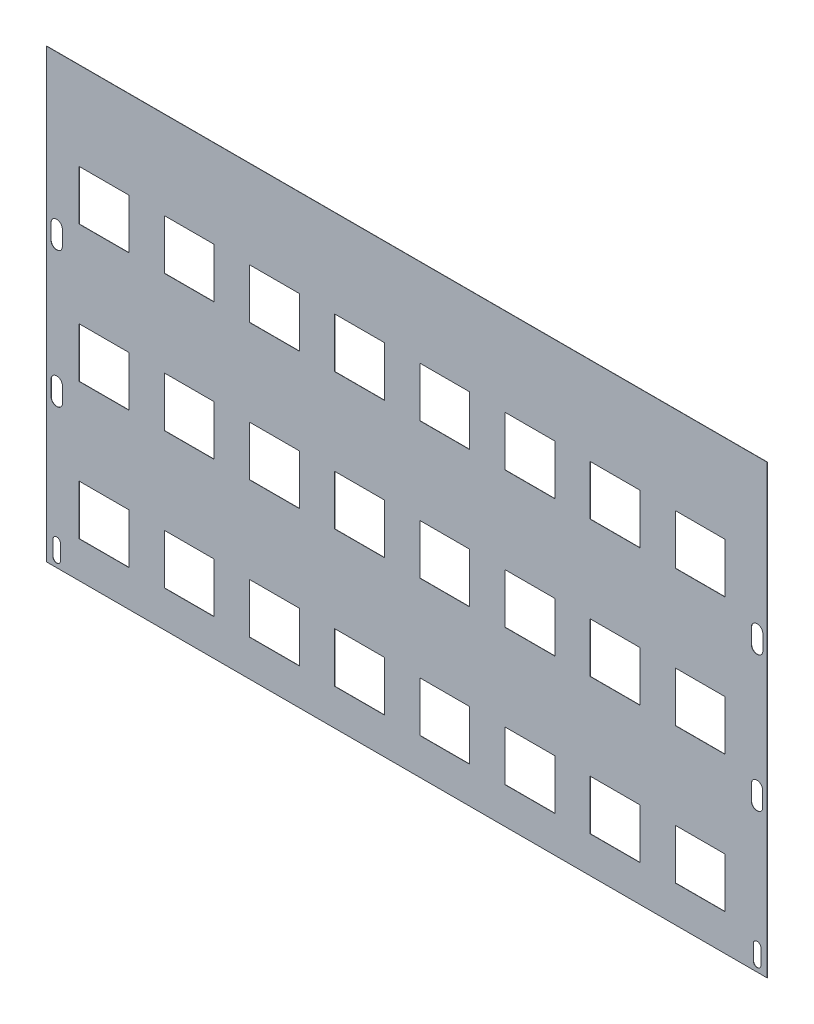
SolidWorks part; units mm, degrees
ref_plane "Front Plane" through (0, 0, 0) normal (0, 0, 1) x (1, 0, 0)
ref_plane "Top Plane" through (0, 0, 0) normal (0, 1, 0) x (1, 0, 0)
ref_plane "Right Plane" through (0, 0, 0) normal (1, 0, 0) x (0, 0, -1)
sketch "Model" plane through (0, 0, 0) normal (0, 0, 1) x (1, 0, 0)
  line L0 (1790, 440) -> (1640, 440)
  line L1 (1640, 440) -> (1640, 595)
  line L2 (1640, 595) -> (1650, 595)
  line L3 (1650, 595) -> (1650, 662)
  line L4 (1650, 662) -> (1780, 662)
  line L5 (1780, 662) -> (1780, 595)
  line L6 (1780, 595) -> (1790, 595)
  line L7 (1790, 595) -> (1790, 440)
  line L8 (1595, 440) -> (1445, 440)
  line L9 (1445, 440) -> (1445, 595)
  line L10 (1445, 595) -> (1455, 595)
  line L11 (1455, 595) -> (1455, 662)
  line L12 (1455, 662) -> (1585, 662)
  line L13 (1585, 662) -> (1585, 595)
  line L14 (1585, 595) -> (1595, 595)
  line L15 (1595, 595) -> (1595, 440)
  line L16 (1400, 440) -> (1250, 440)
  line L17 (1250, 440) -> (1250, 595)
  line L18 (1250, 595) -> (1260, 595)
  line L19 (1260, 595) -> (1260, 662)
  line L20 (1260, 662) -> (1390, 662)
  line L21 (1390, 662) -> (1390, 595)
  line L22 (1390, 595) -> (1400, 595)
  line L23 (1400, 595) -> (1400, 440)
  line L24 (1205, 440) -> (1055, 440)
  line L25 (1055, 440) -> (1055, 595)
  line L26 (1055, 595) -> (1065, 595)
  line L27 (1065, 595) -> (1065, 662)
  line L28 (1065, 662) -> (1195, 662)
  line L29 (1195, 662) -> (1195, 595)
  line L30 (1195, 595) -> (1205, 595)
  line L31 (1205, 595) -> (1205, 440)
  line L32 (1010, 440) -> (860, 440)
  line L33 (860, 440) -> (860, 595)
  line L34 (860, 595) -> (870, 595)
  line L35 (870, 595) -> (870, 662)
  line L36 (870, 662) -> (1000, 662)
  line L37 (1000, 662) -> (1000, 595)
  line L38 (1000, 595) -> (1010, 595)
  line L39 (1010, 595) -> (1010, 440)
  line L40 (815, 440) -> (665, 440)
  line L41 (665, 440) -> (665, 595)
  line L42 (665, 595) -> (675, 595)
  line L43 (675, 595) -> (675, 662)
  line L44 (675, 662) -> (805, 662)
  line L45 (805, 662) -> (805, 595)
  line L46 (805, 595) -> (815, 595)
  line L47 (815, 595) -> (815, 440)
  line L48 (620, 440) -> (470, 440)
  line L49 (470, 440) -> (470, 595)
  line L50 (470, 595) -> (480, 595)
  line L51 (480, 595) -> (480, 662)
  line L52 (480, 662) -> (610, 662)
  line L53 (610, 662) -> (610, 595)
  line L54 (610, 595) -> (620, 595)
  line L55 (620, 595) -> (620, 440)
  line L56 (425, 440) -> (275, 440)
  line L57 (275, 440) -> (275, 595)
  line L58 (275, 595) -> (285, 595)
  line L59 (285, 595) -> (285, 662)
  line L60 (285, 662) -> (415, 662)
  line L61 (415, 662) -> (415, 595)
  line L62 (415, 595) -> (425, 595)
  line L63 (425, 595) -> (425, 440)
  line L64 (230, 440) -> (80, 440)
  line L65 (80, 440) -> (80, 595)
  line L66 (80, 595) -> (90, 595)
  line L67 (90, 595) -> (90, 662)
  line L68 (90, 662) -> (220, 662)
  line L69 (220, 662) -> (220, 595)
  line L70 (220, 595) -> (230, 595)
  line L71 (230, 595) -> (230, 440)
  line L72 (1790, 805) -> (1640, 805)
  line L73 (1640, 805) -> (1640, 960)
  line L74 (1640, 960) -> (1650, 960)
  line L75 (1650, 960) -> (1650, 1027)
  line L76 (1650, 1027) -> (1780, 1027)
  line L77 (1780, 1027) -> (1780, 960)
  line L78 (1780, 960) -> (1790, 960)
  line L79 (1790, 960) -> (1790, 805)
  line L80 (1595, 805) -> (1445, 805)
  line L81 (1445, 805) -> (1445, 960)
  line L82 (1445, 960) -> (1455, 960)
  line L83 (1455, 960) -> (1455, 1027)
  line L84 (1455, 1027) -> (1585, 1027)
  line L85 (1585, 1027) -> (1585, 960)
  line L86 (1585, 960) -> (1595, 960)
  line L87 (1595, 960) -> (1595, 805)
  line L88 (1400, 805) -> (1250, 805)
  line L89 (1250, 805) -> (1250, 960)
  line L90 (1250, 960) -> (1260, 960)
  line L91 (1260, 960) -> (1260, 1027)
  line L92 (1260, 1027) -> (1390, 1027)
  line L93 (1390, 1027) -> (1390, 960)
  line L94 (1390, 960) -> (1400, 960)
  line L95 (1400, 960) -> (1400, 805)
  line L96 (1205, 805) -> (1055, 805)
  line L97 (1055, 805) -> (1055, 960)
  line L98 (1055, 960) -> (1065, 960)
  line L99 (1065, 960) -> (1065, 1027)
  line L100 (1065, 1027) -> (1195, 1027)
  line L101 (1195, 1027) -> (1195, 960)
  line L102 (1195, 960) -> (1205, 960)
  line L103 (1205, 960) -> (1205, 805)
  line L104 (1010, 805) -> (860, 805)
  line L105 (860, 805) -> (860, 960)
  line L106 (860, 960) -> (870, 960)
  line L107 (870, 960) -> (870, 1027)
  line L108 (870, 1027) -> (1000, 1027)
  line L109 (1000, 1027) -> (1000, 960)
  line L110 (1000, 960) -> (1010, 960)
  line L111 (1010, 960) -> (1010, 805)
  line L112 (815, 805) -> (665, 805)
  line L113 (665, 805) -> (665, 960)
  line L114 (665, 960) -> (675, 960)
  line L115 (675, 960) -> (675, 1027)
  line L116 (675, 1027) -> (805, 1027)
  line L117 (805, 1027) -> (805, 960)
  line L118 (805, 960) -> (815, 960)
  line L119 (815, 960) -> (815, 805)
  line L120 (620, 805) -> (470, 805)
  line L121 (470, 805) -> (470, 960)
  line L122 (470, 960) -> (480, 960)
  line L123 (480, 960) -> (480, 1027)
  line L124 (480, 1027) -> (610, 1027)
  line L125 (610, 1027) -> (610, 960)
  line L126 (610, 960) -> (620, 960)
  line L127 (620, 960) -> (620, 805)
  line L128 (425, 805) -> (275, 805)
  line L129 (275, 805) -> (275, 960)
  line L130 (275, 960) -> (285, 960)
  line L131 (285, 960) -> (285, 1027)
  line L132 (285, 1027) -> (415, 1027)
  line L133 (415, 1027) -> (415, 960)
  line L134 (415, 960) -> (425, 960)
  line L135 (425, 960) -> (425, 805)
  line L136 (230, 805) -> (80, 805)
  line L137 (80, 805) -> (80, 960)
  line L138 (80, 960) -> (90, 960)
  line L139 (90, 960) -> (90, 1027)
  line L140 (90, 1027) -> (220, 1027)
  line L141 (220, 1027) -> (220, 960)
  line L142 (220, 960) -> (230, 960)
  line L143 (230, 960) -> (230, 805)
  line L144 (1790, 75) -> (1640, 75)
  line L145 (1640, 75) -> (1640, 230)
  line L146 (1640, 230) -> (1650, 230)
  line L147 (1650, 230) -> (1650, 297)
  line L148 (1650, 297) -> (1780, 297)
  line L149 (1780, 297) -> (1780, 230)
  line L150 (1780, 230) -> (1790, 230)
  line L151 (1790, 230) -> (1790, 75)
  line L152 (1595, 75) -> (1445, 75)
  line L153 (1445, 75) -> (1445, 230)
  line L154 (1445, 230) -> (1455, 230)
  line L155 (1455, 230) -> (1455, 297)
  line L156 (1455, 297) -> (1585, 297)
  line L157 (1585, 297) -> (1585, 230)
  line L158 (1585, 230) -> (1595, 230)
  line L159 (1595, 230) -> (1595, 75)
  line L160 (1400, 75) -> (1250, 75)
  line L161 (1250, 75) -> (1250, 230)
  line L162 (1250, 230) -> (1260, 230)
  line L163 (1260, 230) -> (1260, 297)
  line L164 (1260, 297) -> (1390, 297)
  line L165 (1390, 297) -> (1390, 230)
  line L166 (1390, 230) -> (1400, 230)
  line L167 (1400, 230) -> (1400, 75)
  line L168 (1205, 75) -> (1055, 75)
  line L169 (1055, 75) -> (1055, 230)
  line L170 (1055, 230) -> (1065, 230)
  line L171 (1065, 230) -> (1065, 297)
  line L172 (1065, 297) -> (1195, 297)
  line L173 (1195, 297) -> (1195, 230)
  line L174 (1195, 230) -> (1205, 230)
  line L175 (1205, 230) -> (1205, 75)
  line L176 (1010, 75) -> (860, 75)
  line L177 (860, 75) -> (860, 230)
  line L178 (860, 230) -> (870, 230)
  line L179 (870, 230) -> (870, 297)
  line L180 (870, 297) -> (1000, 297)
  line L181 (1000, 297) -> (1000, 230)
  line L182 (1000, 230) -> (1010, 230)
  line L183 (1010, 230) -> (1010, 75)
  line L184 (815, 75) -> (665, 75)
  line L185 (665, 75) -> (665, 230)
  line L186 (665, 230) -> (675, 230)
  line L187 (675, 230) -> (675, 297)
  line L188 (675, 297) -> (805, 297)
  line L189 (805, 297) -> (805, 230)
  line L190 (805, 230) -> (815, 230)
  line L191 (815, 230) -> (815, 75)
  line L192 (620, 75) -> (470, 75)
  line L193 (470, 75) -> (470, 230)
  line L194 (470, 230) -> (480, 230)
  line L195 (480, 230) -> (480, 297)
  line L196 (480, 297) -> (610, 297)
  line L197 (610, 297) -> (610, 230)
  line L198 (610, 230) -> (620, 230)
  line L199 (620, 230) -> (620, 75)
  line L200 (425, 75) -> (275, 75)
  line L201 (275, 75) -> (275, 230)
  line L202 (275, 230) -> (285, 230)
  line L203 (285, 230) -> (285, 297)
  line L204 (285, 297) -> (415, 297)
  line L205 (415, 297) -> (415, 230)
  line L206 (415, 230) -> (425, 230)
  line L207 (425, 230) -> (425, 75)
  line L208 (230, 75) -> (80, 75)
  line L209 (80, 75) -> (80, 230)
  line L210 (80, 230) -> (90, 230)
  line L211 (90, 230) -> (90, 297)
  line L212 (90, 297) -> (220, 297)
  line L213 (220, 297) -> (220, 230)
  line L214 (220, 230) -> (230, 230)
  line L215 (230, 230) -> (230, 75)
  line L216 (0, 1180) -> (0, 0)
  line L217 (0, 0) -> (1870, 0)
  line L218 (1870, 0) -> (1870, 1180)
  line L219 (1870, 1180) -> (0, 1180)
  dimension "D1" = 3
base flange "Base-Flange1" sketch "Model" thickness 0.6 reverse thickness direction no parameters "D1"=0.7366
sketch "Sketch6" plane through (0, 0, 0) normal (0, 0, 1) x (1, 0, 0)
  line L3 (1705, 805) -> (1725, 805)
  line L7 (1725, 1027) -> (1705, 1027)
  line L8 (1779, 1026) -> (1725, 1026)
  line L9 (1651, 1026) -> (1651, 959)
  line L10 (1651, 959) -> (1641, 959)
  line L11 (1641, 959) -> (1641, 806)
  line L12 (1641, 806) -> (1705, 806)
  line L13 (1789, 806) -> (1789, 959)
  line L14 (1789, 959) -> (1779, 959)
  line L15 (1779, 959) -> (1779, 1026)
  line L16 (1705, 1026) -> (1651, 1026)
  line L17 (1780, 1027) -> (1650, 1027) construction
  line L18 (1705, 1027) -> (1705, 1026)
  line L19 (1725, 1027) -> (1725, 1026)
  line L20 (1705, 806) -> (1705, 805)
  line L21 (1725, 806) -> (1725, 805)
  line L22 (1725, 806) -> (1789, 806)
  line L23 (1641, 806) -> (1789, 806) construction
  line L24 (1779, 1026) -> (1651, 1026) construction
  line L25 (1640, 805) -> (1790, 805) construction
  line L26 (1650, 1027) -> (1650, 960) construction
  line L27 (1650, 960) -> (1640, 960) construction
  line L28 (1640, 960) -> (1640, 805) construction
  line L29 (1790, 805) -> (1790, 960) construction
  line L30 (1790, 960) -> (1780, 960) construction
  line L31 (1780, 960) -> (1780, 1027) construction
  line L32 (1705, 440) -> (1725, 440)
  line L33 (1725, 662) -> (1705, 662)
  line L34 (1779, 661) -> (1725, 661)
  line L35 (1651, 661) -> (1651, 594)
  line L36 (1651, 594) -> (1641, 594)
  line L37 (1641, 594) -> (1641, 441)
  line L38 (1641, 441) -> (1705, 441)
  line L39 (1789, 441) -> (1789, 594)
  line L40 (1789, 594) -> (1779, 594)
  line L41 (1779, 594) -> (1779, 661)
  line L42 (1705, 661) -> (1651, 661)
  line L43 (1705, 662) -> (1705, 661)
  line L44 (1725, 662) -> (1725, 661)
  line L45 (1705, 441) -> (1705, 440)
  line L46 (1725, 441) -> (1725, 440)
  line L47 (1725, 441) -> (1789, 441)
  line L48 (1705, 75) -> (1725, 75)
  line L49 (1725, 297) -> (1705, 297)
  line L50 (1779, 296) -> (1725, 296)
  line L51 (1651, 296) -> (1651, 229)
  line L52 (1651, 229) -> (1641, 229)
  line L53 (1641, 229) -> (1641, 76)
  line L54 (1641, 76) -> (1705, 76)
  line L55 (1789, 76) -> (1789, 229)
  line L56 (1789, 229) -> (1779, 229)
  line L57 (1779, 229) -> (1779, 296)
  line L58 (1705, 296) -> (1651, 296)
  line L59 (1705, 297) -> (1705, 296)
  line L60 (1725, 297) -> (1725, 296)
  line L61 (1705, 76) -> (1705, 75)
  line L62 (1725, 76) -> (1725, 75)
  line L63 (1725, 76) -> (1789, 76)
  dimension "D1" = 1
  dimension "D2" = 3
base flange "Tab1" sketch "Sketch6" thickness 0.6 reverse thickness direction no parameters "D1"=0.7366
sketch "Sketch7" plane through (0, 0, 0) normal (0, 0, 1) x (1, 0, 0)
  line L1 (1870, 1180) -> (1935, 1180)
  line L2 (1870, 1180) -> (1870, 0)
  line L3 (1870, 0) -> (1935, 0)
  line L4 (1935, 1180) -> (1935, 0)
  line L5 (0, 0) -> (-65, 0)
  line L6 (0, 0) -> (0, 1180)
  line L7 (0, 1180) -> (-65, 1180)
  line L8 (-65, 0) -> (-65, 1180)
  dimension "D1" = 65
  dimension "D2" = 65
base flange "Tab2" sketch "Sketch7" thickness 0.6 reverse thickness direction no parameters "D1"=0.7366
sketch "Sketch9" plane through (0, 0, 0) normal (0, 0, 1) x (1, 0, 0)
  line L1 (30.4802, 1078.5447) -> (1870.8092, 1078.5447)
  line L2 (30.4802, 1078.5447) -> (30.4802, 32.6023)
  line L3 (30.4802, 32.6023) -> (1870.8092, 32.6023)
  line L4 (1870.8092, 1078.5447) -> (1870.8092, 32.6023)
extrude "Boss-Extrude1" add sketch "Sketch9" against normal up to surface (0.6 mm away)
sketch "Sketch8" plane through (0, 0, 0) normal (0, 0, 1) x (1, 0, 0)
  line L312 (21.0507, 947.9116) -> (21.0507, 815.9116)
  line L313 (21.0507, 815.9116) -> (153.0507, 815.9116)
  line L314 (153.0507, 815.9116) -> (153.0507, 947.9116)
  line L315 (153.0507, 947.9116) -> (21.0507, 947.9116)
  line L340 (21.0507, 587.9116) -> (21.0507, 455.9116)
  line L341 (21.0507, 455.9116) -> (153.0507, 455.9116)
  line L342 (153.0507, 455.9116) -> (153.0507, 587.9116)
  line L343 (153.0507, 587.9116) -> (21.0507, 587.9116)
  line L368 (21.0507, 227.9116) -> (21.0507, 95.9116)
  line L369 (21.0507, 95.9116) -> (153.0507, 95.9116)
  line L370 (153.0507, 95.9116) -> (153.0507, 227.9116)
  line L371 (153.0507, 227.9116) -> (21.0507, 227.9116)
  line L548 (246.0507, 947.9116) -> (246.0507, 815.9116)
  line L549 (246.0507, 815.9116) -> (378.0507, 815.9116)
  line L550 (378.0507, 815.9116) -> (378.0507, 947.9116)
  line L551 (378.0507, 947.9116) -> (246.0507, 947.9116)
  line L552 (246.0507, 587.9116) -> (246.0507, 455.9116)
  line L553 (246.0507, 455.9116) -> (378.0507, 455.9116)
  line L554 (378.0507, 455.9116) -> (378.0507, 587.9116)
  line L555 (378.0507, 587.9116) -> (246.0507, 587.9116)
  line L556 (246.0507, 227.9116) -> (246.0507, 95.9116)
  line L557 (246.0507, 95.9116) -> (378.0507, 95.9116)
  line L558 (378.0507, 95.9116) -> (378.0507, 227.9116)
  line L559 (378.0507, 227.9116) -> (246.0507, 227.9116)
  line L560 (471.0507, 947.9116) -> (471.0507, 815.9116)
  line L561 (471.0507, 815.9116) -> (603.0507, 815.9116)
  line L562 (603.0507, 815.9116) -> (603.0507, 947.9116)
  line L563 (603.0507, 947.9116) -> (471.0507, 947.9116)
  line L564 (471.0507, 587.9116) -> (471.0507, 455.9116)
  line L565 (471.0507, 455.9116) -> (603.0507, 455.9116)
  line L566 (603.0507, 455.9116) -> (603.0507, 587.9116)
  line L567 (603.0507, 587.9116) -> (471.0507, 587.9116)
  line L568 (471.0507, 227.9116) -> (471.0507, 95.9116)
  line L569 (471.0507, 95.9116) -> (603.0507, 95.9116)
  line L570 (603.0507, 95.9116) -> (603.0507, 227.9116)
  line L571 (603.0507, 227.9116) -> (471.0507, 227.9116)
  line L572 (696.0507, 947.9116) -> (696.0507, 815.9116)
  line L573 (696.0507, 815.9116) -> (828.0507, 815.9116)
  line L574 (828.0507, 815.9116) -> (828.0507, 947.9116)
  line L575 (828.0507, 947.9116) -> (696.0507, 947.9116)
  line L576 (696.0507, 587.9116) -> (696.0507, 455.9116)
  line L577 (696.0507, 455.9116) -> (828.0507, 455.9116)
  line L578 (828.0507, 455.9116) -> (828.0507, 587.9116)
  line L579 (828.0507, 587.9116) -> (696.0507, 587.9116)
  line L580 (696.0507, 227.9116) -> (696.0507, 95.9116)
  line L581 (696.0507, 95.9116) -> (828.0507, 95.9116)
  line L582 (828.0507, 95.9116) -> (828.0507, 227.9116)
  line L583 (828.0507, 227.9116) -> (696.0507, 227.9116)
  line L584 (921.0507, 947.9116) -> (921.0507, 815.9116)
  line L585 (921.0507, 815.9116) -> (1053.0507, 815.9116)
  line L586 (1053.0507, 815.9116) -> (1053.0507, 947.9116)
  line L587 (1053.0507, 947.9116) -> (921.0507, 947.9116)
  line L588 (921.0507, 587.9116) -> (921.0507, 455.9116)
  line L589 (921.0507, 455.9116) -> (1053.0507, 455.9116)
  line L590 (1053.0507, 455.9116) -> (1053.0507, 587.9116)
  line L591 (1053.0507, 587.9116) -> (921.0507, 587.9116)
  line L592 (921.0507, 227.9116) -> (921.0507, 95.9116)
  line L593 (921.0507, 95.9116) -> (1053.0507, 95.9116)
  line L594 (1053.0507, 95.9116) -> (1053.0507, 227.9116)
  line L595 (1053.0507, 227.9116) -> (921.0507, 227.9116)
  line L596 (1146.0507, 947.9116) -> (1146.0507, 815.9116)
  line L597 (1146.0507, 815.9116) -> (1278.0507, 815.9116)
  line L598 (1278.0507, 815.9116) -> (1278.0507, 947.9116)
  line L599 (1278.0507, 947.9116) -> (1146.0507, 947.9116)
  line L600 (1146.0507, 587.9116) -> (1146.0507, 455.9116)
  line L601 (1146.0507, 455.9116) -> (1278.0507, 455.9116)
  line L602 (1278.0507, 455.9116) -> (1278.0507, 587.9116)
  line L603 (1278.0507, 587.9116) -> (1146.0507, 587.9116)
  line L604 (1146.0507, 227.9116) -> (1146.0507, 95.9116)
  line L605 (1146.0507, 95.9116) -> (1278.0507, 95.9116)
  line L606 (1278.0507, 95.9116) -> (1278.0507, 227.9116)
  line L607 (1278.0507, 227.9116) -> (1146.0507, 227.9116)
  line L608 (1371.0507, 947.9116) -> (1371.0507, 815.9116)
  line L609 (1371.0507, 815.9116) -> (1503.0507, 815.9116)
  line L610 (1503.0507, 815.9116) -> (1503.0507, 947.9116)
  line L611 (1503.0507, 947.9116) -> (1371.0507, 947.9116)
  line L612 (1371.0507, 587.9116) -> (1371.0507, 455.9116)
  line L613 (1371.0507, 455.9116) -> (1503.0507, 455.9116)
  line L614 (1503.0507, 455.9116) -> (1503.0507, 587.9116)
  line L615 (1503.0507, 587.9116) -> (1371.0507, 587.9116)
  line L616 (1371.0507, 227.9116) -> (1371.0507, 95.9116)
  line L617 (1371.0507, 95.9116) -> (1503.0507, 95.9116)
  line L618 (1503.0507, 95.9116) -> (1503.0507, 227.9116)
  line L619 (1503.0507, 227.9116) -> (1371.0507, 227.9116)
  line L620 (1596.0507, 947.9116) -> (1596.0507, 815.9116)
  line L621 (1596.0507, 815.9116) -> (1728.0507, 815.9116)
  line L622 (1728.0507, 815.9116) -> (1728.0507, 947.9116)
  line L623 (1728.0507, 947.9116) -> (1596.0507, 947.9116)
  line L624 (1596.0507, 587.9116) -> (1596.0507, 455.9116)
  line L625 (1596.0507, 455.9116) -> (1728.0507, 455.9116)
  line L626 (1728.0507, 455.9116) -> (1728.0507, 587.9116)
  line L627 (1728.0507, 587.9116) -> (1596.0507, 587.9116)
  line L628 (1596.0507, 227.9116) -> (1596.0507, 95.9116)
  line L629 (1596.0507, 95.9116) -> (1728.0507, 95.9116)
  line L630 (1728.0507, 95.9116) -> (1728.0507, 227.9116)
  line L631 (1728.0507, 227.9116) -> (1596.0507, 227.9116)
  dimension "D1" = 8
extrude "Cut-Extrude1" cut sketch "Sketch8" against normal blind 10
sketch "Sketch10" plane through (0, 0, 0) normal (0, 0, 1) x (1, 0, 0)
  line L0 (-65, 0) -> (1935, 0) construction
  line L1 (1935, 1180) -> (1839, 1180)
  line L2 (1935, 1180) -> (1935, 0)
  line L3 (1935, 0) -> (1839, 0)
  line L4 (1839, 1180) -> (1839, 0)
  dimension "D1" = 96
extrude "Cut-Extrude2" cut sketch "Sketch10" against normal blind 506
sketch "Sketch11" plane through (0, 0, -0.6) normal (0, 0, -1) x (-1, 0, 0)
  line L0 (38.2604, 782.1156) -> (38.2604, 742.1156) construction
  line L1 (53.2604, 782.1156) -> (53.2604, 742.1156)
  line L2 (23.2604, 782.1156) -> (23.2604, 742.1156)
  line L3 (38, 423.9116) -> (38, 383.9116) construction
  line L4 (53, 423.9116) -> (53, 383.9116)
  line L5 (23, 423.9116) -> (23, 383.9116)
  line L6 (38.2604, 60.6389) -> (38.2604, 20.6389) construction
  line L7 (48.2604, 60.6389) -> (48.2604, 20.6389)
  line L8 (28.2604, 60.6389) -> (28.2604, 20.6389)
  arc A0 (53.2604, 782.1156) -> (23.2604, 782.1156) centre (38.2604, 782.1156) ccw
  arc A1 (23.2604, 742.1156) -> (53.2604, 742.1156) centre (38.2604, 742.1156) ccw
  arc A2 (53, 423.9116) -> (23, 423.9116) centre (38, 423.9116) ccw
  arc A3 (23, 383.9116) -> (53, 383.9116) centre (38, 383.9116) ccw
  arc A4 (48.2604, 60.6389) -> (28.2604, 60.6389) centre (38.2604, 60.6389) ccw
  arc A5 (28.2604, 20.6389) -> (48.2604, 20.6389) centre (38.2604, 20.6389) ccw
  point P2 (38.2604, 762.1156)
  point P12 (38, 403.9116)
  point P21 (38.2604, 40.6389)
  dimension "D3" = 15
  dimension "D4" = 10
  dimension "D1" = 30
  dimension "D2" = 40
extrude "Cut-Extrude3" cut sketch "Sketch11" against normal blind 10
ref_plane "Plane1" through (887, 0, 0) normal (-1, 0, 0) x (0, 0, 1)
mirror "Mirror1" about plane through (887, 0, 0) normal (-1, 0, 0) of "Cut-Extrude3"
sketch "Bend-Lines1" [suppressed] plane through (0, 0, 0) normal (0, 1, 0) x (1, 0, 0)
sketch "Bounding-Box1" [suppressed] plane through (0, 0, 0) normal (0, 1, 0) x (1, 0, 0)
sheet metal parameters "Sheet-Metal1" thickness 0.6 parameters "D1"=0.7366
flat pattern "Flat-Pattern1"
sketch "Bend-Lines2" plane through (0, 0, 0) normal (0, 1, 0) x (1, 0, 0)
sketch3d "Bounding-Box2" [suppressed]
  line L0 (0, 0, 0) -> (-1870, 0, 0) construction
  line L1 (0, 1180, 0) -> (-1870, 1180, 0) construction
  line L2 (0, 0, 0) -> (0, 1180, 0) construction
  line L3 (-1870, 0, 0) -> (-1870, 1180, 0) construction
sheet metal parameters "Sheet-Metal2" thickness 0.6 parameters "D1"=0.7366
flat pattern "Flat-Pattern2"
sketch "Bend-Lines3" plane through (0, 0, 0) normal (0, 1, 0) x (1, 0, 0)
sketch3d "Bounding-Box3" [suppressed]
  line L0 (0, 0, 0) -> (-1870, 0, 0) construction
  line L1 (0, 1180, 0) -> (-1870, 1180, 0) construction
  line L2 (0, 0, 0) -> (0, 1180, 0) construction
  line L3 (-1870, 0, 0) -> (-1870, 1180, 0) construction
sheet metal parameters "Sheet-Metal5" thickness 0.6 parameters "D1"=0.7366
flat pattern "Flat-Pattern5"
sketch "Bend-Lines4" plane through (0, 0, 0) normal (0, 1, 0) x (1, 0, 0)
sketch3d "Bounding-Box4" [suppressed]
  line L0 (65, 0, 0) -> (-1935, 0, 0) construction
  line L1 (65, 1180, 0) -> (-1935, 1180, 0) construction
  line L2 (65, 0, 0) -> (65, 1180, 0) construction
  line L3 (-1935, 0, 0) -> (-1935, 1180, 0) construction
sheet metal parameters "Sheet-Metal6" thickness 0.6 parameters "D1"=0.7366
flat pattern "Flat-Pattern5"
sketch "Bend-Lines4" plane through (0, 0, 0) normal (0, 1, 0) x (1, 0, 0)
sketch3d "Bounding-Box4" [suppressed]
  line L0 (65, 0, 0) -> (-1935, 0, 0) construction
  line L1 (65, 1180, 0) -> (-1935, 1180, 0) construction
  line L2 (65, 0, 0) -> (65, 1180, 0) construction
  line L3 (-1935, 0, 0) -> (-1935, 1180, 0) construction
sketch "Sketch8-1" plane through (0, 0, 0) normal (0, 0, 1) x (1, 0, 0)
  line L0 (91.0507, 947.9116) -> (91.0507, 815.9116)
  line L1 (223.0507, 947.9116) -> (91.0507, 947.9116)
  line L2 (223.0507, 815.9116) -> (223.0507, 947.9116)
  line L3 (91.0507, 815.9116) -> (223.0507, 815.9116)
  line L4 (67.0507, 1045.9116) -> (82.0507, 1045.9116)
  line L5 (232.0507, 1045.9116) -> (82.0507, 1045.9116)
  line L6 (247.0507, 1045.9116) -> (232.0507, 1045.9116)
  line L7 (247.0507, 968.9116) -> (247.0507, 1045.9116)
  line L8 (247.0507, 793.9116) -> (247.0507, 968.9116)
  line L9 (67.0507, 793.9116) -> (247.0507, 793.9116)
  line L10 (67.0507, 973.9116) -> (67.0507, 793.9116)
  line L11 (67.0507, 973.9116) -> (67.0507, 1045.9116)
  line L12 (321.0507, 947.9116) -> (321.0507, 815.9116)
  line L13 (453.0507, 947.9116) -> (321.0507, 947.9116)
  line L14 (453.0507, 815.9116) -> (453.0507, 947.9116)
  line L15 (321.0507, 815.9116) -> (453.0507, 815.9116)
  line L16 (297.0507, 1045.9116) -> (312.0507, 1045.9116)
  line L17 (462.0507, 1045.9116) -> (312.0507, 1045.9116)
  line L18 (477.0507, 1045.9116) -> (462.0507, 1045.9116)
  line L19 (477.0507, 968.9116) -> (477.0507, 1045.9116)
  line L20 (477.0507, 793.9116) -> (477.0507, 968.9116)
  line L21 (297.0507, 793.9116) -> (477.0507, 793.9116)
  line L22 (297.0507, 973.9116) -> (297.0507, 793.9116)
  line L23 (297.0507, 973.9116) -> (297.0507, 1045.9116)
  line L24 (551.0507, 947.9116) -> (551.0507, 815.9116)
  line L25 (683.0507, 947.9116) -> (551.0507, 947.9116)
  line L26 (683.0507, 815.9116) -> (683.0507, 947.9116)
  line L27 (551.0507, 815.9116) -> (683.0507, 815.9116)
  line L28 (527.0507, 1045.9116) -> (542.0507, 1045.9116)
  line L29 (692.0507, 1045.9116) -> (542.0507, 1045.9116)
  line L30 (707.0507, 1045.9116) -> (692.0507, 1045.9116)
  line L31 (707.0507, 968.9116) -> (707.0507, 1045.9116)
  line L32 (707.0507, 793.9116) -> (707.0507, 968.9116)
  line L33 (527.0507, 793.9116) -> (707.0507, 793.9116)
  line L34 (527.0507, 973.9116) -> (527.0507, 793.9116)
  line L35 (527.0507, 973.9116) -> (527.0507, 1045.9116)
  line L36 (781.0507, 947.9116) -> (781.0507, 815.9116)
  line L37 (913.0507, 947.9116) -> (781.0507, 947.9116)
  line L38 (913.0507, 815.9116) -> (913.0507, 947.9116)
  line L39 (781.0507, 815.9116) -> (913.0507, 815.9116)
  line L40 (757.0507, 1045.9116) -> (772.0507, 1045.9116)
  line L41 (922.0507, 1045.9116) -> (772.0507, 1045.9116)
  line L42 (937.0507, 1045.9116) -> (922.0507, 1045.9116)
  line L43 (937.0507, 968.9116) -> (937.0507, 1045.9116)
  line L44 (937.0507, 793.9116) -> (937.0507, 968.9116)
  line L45 (757.0507, 793.9116) -> (937.0507, 793.9116)
  line L46 (757.0507, 973.9116) -> (757.0507, 793.9116)
  line L47 (757.0507, 973.9116) -> (757.0507, 1045.9116)
  line L48 (1011.0507, 947.9116) -> (1011.0507, 815.9116)
  line L49 (1143.0507, 947.9116) -> (1011.0507, 947.9116)
  line L50 (1143.0507, 815.9116) -> (1143.0507, 947.9116)
  line L51 (1011.0507, 815.9116) -> (1143.0507, 815.9116)
  line L52 (987.0507, 1045.9116) -> (1002.0507, 1045.9116)
  line L53 (1152.0507, 1045.9116) -> (1002.0507, 1045.9116)
  line L54 (1167.0507, 1045.9116) -> (1152.0507, 1045.9116)
  line L55 (1167.0507, 968.9116) -> (1167.0507, 1045.9116)
  line L56 (1167.0507, 793.9116) -> (1167.0507, 968.9116)
  line L57 (987.0507, 793.9116) -> (1167.0507, 793.9116)
  line L58 (987.0507, 973.9116) -> (987.0507, 793.9116)
  line L59 (987.0507, 973.9116) -> (987.0507, 1045.9116)
  line L60 (1241.0507, 947.9116) -> (1241.0507, 815.9116)
  line L61 (1373.0507, 947.9116) -> (1241.0507, 947.9116)
  line L62 (1373.0507, 815.9116) -> (1373.0507, 947.9116)
  line L63 (1241.0507, 815.9116) -> (1373.0507, 815.9116)
  line L64 (1217.0507, 1045.9116) -> (1232.0507, 1045.9116)
  line L65 (1382.0507, 1045.9116) -> (1232.0507, 1045.9116)
  line L66 (1397.0507, 1045.9116) -> (1382.0507, 1045.9116)
  line L67 (1397.0507, 968.9116) -> (1397.0507, 1045.9116)
  line L68 (1397.0507, 793.9116) -> (1397.0507, 968.9116)
  line L69 (1217.0507, 793.9116) -> (1397.0507, 793.9116)
  line L70 (1217.0507, 973.9116) -> (1217.0507, 793.9116)
  line L71 (1217.0507, 973.9116) -> (1217.0507, 1045.9116)
  line L72 (1471.0507, 947.9116) -> (1471.0507, 815.9116)
  line L73 (1603.0507, 947.9116) -> (1471.0507, 947.9116)
  line L74 (1603.0507, 815.9116) -> (1603.0507, 947.9116)
  line L75 (1471.0507, 815.9116) -> (1603.0507, 815.9116)
  line L76 (1447.0507, 1045.9116) -> (1462.0507, 1045.9116)
  line L77 (1612.0507, 1045.9116) -> (1462.0507, 1045.9116)
  line L78 (1627.0507, 1045.9116) -> (1612.0507, 1045.9116)
  line L79 (1627.0507, 968.9116) -> (1627.0507, 1045.9116)
  line L80 (1627.0507, 793.9116) -> (1627.0507, 968.9116)
  line L81 (1447.0507, 793.9116) -> (1627.0507, 793.9116)
  line L82 (1447.0507, 973.9116) -> (1447.0507, 793.9116)
  line L83 (1447.0507, 973.9116) -> (1447.0507, 1045.9116)
  line L84 (1701.0507, 947.9116) -> (1701.0507, 815.9116)
  line L85 (1833.0507, 947.9116) -> (1701.0507, 947.9116)
  line L86 (1833.0507, 815.9116) -> (1833.0507, 947.9116)
  line L87 (1701.0507, 815.9116) -> (1833.0507, 815.9116)
  line L88 (1677.0507, 1045.9116) -> (1692.0507, 1045.9116)
  line L89 (1842.0507, 1045.9116) -> (1692.0507, 1045.9116)
  line L90 (1857.0507, 1045.9116) -> (1842.0507, 1045.9116)
  line L91 (1857.0507, 968.9116) -> (1857.0507, 1045.9116)
  line L92 (1857.0507, 793.9116) -> (1857.0507, 968.9116)
  line L93 (1677.0507, 793.9116) -> (1857.0507, 793.9116)
  line L94 (1677.0507, 973.9116) -> (1677.0507, 793.9116)
  line L95 (1677.0507, 973.9116) -> (1677.0507, 1045.9116)
  line L96 (91.0507, 587.9116) -> (91.0507, 455.9116)
  line L97 (223.0507, 587.9116) -> (91.0507, 587.9116)
  line L98 (223.0507, 455.9116) -> (223.0507, 587.9116)
  line L99 (91.0507, 455.9116) -> (223.0507, 455.9116)
  line L100 (67.0507, 685.9116) -> (82.0507, 685.9116)
  line L101 (232.0507, 685.9116) -> (82.0507, 685.9116)
  line L102 (247.0507, 685.9116) -> (232.0507, 685.9116)
  line L103 (247.0507, 608.9116) -> (247.0507, 685.9116)
  line L104 (247.0507, 433.9116) -> (247.0507, 608.9116)
  line L105 (67.0507, 433.9116) -> (247.0507, 433.9116)
  line L106 (67.0507, 613.9116) -> (67.0507, 433.9116)
  line L107 (67.0507, 613.9116) -> (67.0507, 685.9116)
  line L108 (321.0507, 587.9116) -> (321.0507, 455.9116)
  line L109 (453.0507, 587.9116) -> (321.0507, 587.9116)
  line L110 (453.0507, 455.9116) -> (453.0507, 587.9116)
  line L111 (321.0507, 455.9116) -> (453.0507, 455.9116)
  line L112 (297.0507, 685.9116) -> (312.0507, 685.9116)
  line L113 (462.0507, 685.9116) -> (312.0507, 685.9116)
  line L114 (477.0507, 685.9116) -> (462.0507, 685.9116)
  line L115 (477.0507, 608.9116) -> (477.0507, 685.9116)
  line L116 (477.0507, 433.9116) -> (477.0507, 608.9116)
  line L117 (297.0507, 433.9116) -> (477.0507, 433.9116)
  line L118 (297.0507, 613.9116) -> (297.0507, 433.9116)
  line L119 (297.0507, 613.9116) -> (297.0507, 685.9116)
  line L120 (551.0507, 587.9116) -> (551.0507, 455.9116)
  line L121 (683.0507, 587.9116) -> (551.0507, 587.9116)
  line L122 (683.0507, 455.9116) -> (683.0507, 587.9116)
  line L123 (551.0507, 455.9116) -> (683.0507, 455.9116)
  line L124 (527.0507, 685.9116) -> (542.0507, 685.9116)
  line L125 (692.0507, 685.9116) -> (542.0507, 685.9116)
  line L126 (707.0507, 685.9116) -> (692.0507, 685.9116)
  line L127 (707.0507, 608.9116) -> (707.0507, 685.9116)
  line L128 (707.0507, 433.9116) -> (707.0507, 608.9116)
  line L129 (527.0507, 433.9116) -> (707.0507, 433.9116)
  line L130 (527.0507, 613.9116) -> (527.0507, 433.9116)
  line L131 (527.0507, 613.9116) -> (527.0507, 685.9116)
  line L132 (781.0507, 587.9116) -> (781.0507, 455.9116)
  line L133 (913.0507, 587.9116) -> (781.0507, 587.9116)
  line L134 (913.0507, 455.9116) -> (913.0507, 587.9116)
  line L135 (781.0507, 455.9116) -> (913.0507, 455.9116)
  line L136 (757.0507, 685.9116) -> (772.0507, 685.9116)
  line L137 (922.0507, 685.9116) -> (772.0507, 685.9116)
  line L138 (937.0507, 685.9116) -> (922.0507, 685.9116)
  line L139 (937.0507, 608.9116) -> (937.0507, 685.9116)
  line L140 (937.0507, 433.9116) -> (937.0507, 608.9116)
  line L141 (757.0507, 433.9116) -> (937.0507, 433.9116)
  line L142 (757.0507, 613.9116) -> (757.0507, 433.9116)
  line L143 (757.0507, 613.9116) -> (757.0507, 685.9116)
  line L144 (1011.0507, 587.9116) -> (1011.0507, 455.9116)
  line L145 (1143.0507, 587.9116) -> (1011.0507, 587.9116)
  line L146 (1143.0507, 455.9116) -> (1143.0507, 587.9116)
  line L147 (1011.0507, 455.9116) -> (1143.0507, 455.9116)
  line L148 (987.0507, 685.9116) -> (1002.0507, 685.9116)
  line L149 (1152.0507, 685.9116) -> (1002.0507, 685.9116)
  line L150 (1167.0507, 685.9116) -> (1152.0507, 685.9116)
  line L151 (1167.0507, 608.9116) -> (1167.0507, 685.9116)
  line L152 (1167.0507, 433.9116) -> (1167.0507, 608.9116)
  line L153 (987.0507, 433.9116) -> (1167.0507, 433.9116)
  line L154 (987.0507, 613.9116) -> (987.0507, 433.9116)
  line L155 (987.0507, 613.9116) -> (987.0507, 685.9116)
  line L156 (1241.0507, 587.9116) -> (1241.0507, 455.9116)
  line L157 (1373.0507, 587.9116) -> (1241.0507, 587.9116)
  line L158 (1373.0507, 455.9116) -> (1373.0507, 587.9116)
  line L159 (1241.0507, 455.9116) -> (1373.0507, 455.9116)
  line L160 (1217.0507, 685.9116) -> (1232.0507, 685.9116)
  line L161 (1382.0507, 685.9116) -> (1232.0507, 685.9116)
  line L162 (1397.0507, 685.9116) -> (1382.0507, 685.9116)
  line L163 (1397.0507, 608.9116) -> (1397.0507, 685.9116)
  line L164 (1397.0507, 433.9116) -> (1397.0507, 608.9116)
  line L165 (1217.0507, 433.9116) -> (1397.0507, 433.9116)
  line L166 (1217.0507, 613.9116) -> (1217.0507, 433.9116)
  line L167 (1217.0507, 613.9116) -> (1217.0507, 685.9116)
  line L168 (1471.0507, 587.9116) -> (1471.0507, 455.9116)
  line L169 (1603.0507, 587.9116) -> (1471.0507, 587.9116)
  line L170 (1603.0507, 455.9116) -> (1603.0507, 587.9116)
  line L171 (1471.0507, 455.9116) -> (1603.0507, 455.9116)
  line L172 (1447.0507, 685.9116) -> (1462.0507, 685.9116)
  line L173 (1612.0507, 685.9116) -> (1462.0507, 685.9116)
  line L174 (1627.0507, 685.9116) -> (1612.0507, 685.9116)
  line L175 (1627.0507, 608.9116) -> (1627.0507, 685.9116)
  line L176 (1627.0507, 433.9116) -> (1627.0507, 608.9116)
  line L177 (1447.0507, 433.9116) -> (1627.0507, 433.9116)
  line L178 (1447.0507, 613.9116) -> (1447.0507, 433.9116)
  line L179 (1447.0507, 613.9116) -> (1447.0507, 685.9116)
  line L180 (1701.0507, 587.9116) -> (1701.0507, 455.9116)
  line L181 (1833.0507, 587.9116) -> (1701.0507, 587.9116)
  line L182 (1833.0507, 455.9116) -> (1833.0507, 587.9116)
  line L183 (1701.0507, 455.9116) -> (1833.0507, 455.9116)
  line L184 (1677.0507, 685.9116) -> (1692.0507, 685.9116)
  line L185 (1842.0507, 685.9116) -> (1692.0507, 685.9116)
  line L186 (1857.0507, 685.9116) -> (1842.0507, 685.9116)
  line L187 (1857.0507, 608.9116) -> (1857.0507, 685.9116)
  line L188 (1857.0507, 433.9116) -> (1857.0507, 608.9116)
  line L189 (1677.0507, 433.9116) -> (1857.0507, 433.9116)
  line L190 (1677.0507, 613.9116) -> (1677.0507, 433.9116)
  line L191 (1677.0507, 613.9116) -> (1677.0507, 685.9116)
  line L192 (91.0507, 227.9116) -> (91.0507, 95.9116)
  line L193 (223.0507, 227.9116) -> (91.0507, 227.9116)
  line L194 (223.0507, 95.9116) -> (223.0507, 227.9116)
  line L195 (91.0507, 95.9116) -> (223.0507, 95.9116)
  line L196 (67.0507, 325.9116) -> (82.0507, 325.9116)
  line L197 (232.0507, 325.9116) -> (82.0507, 325.9116)
  line L198 (247.0507, 325.9116) -> (232.0507, 325.9116)
  line L199 (247.0507, 248.9116) -> (247.0507, 325.9116)
  line L200 (247.0507, 73.9116) -> (247.0507, 248.9116)
  line L201 (67.0507, 73.9116) -> (247.0507, 73.9116)
  line L202 (67.0507, 253.9116) -> (67.0507, 73.9116)
  line L203 (67.0507, 253.9116) -> (67.0507, 325.9116)
  line L204 (321.0507, 227.9116) -> (321.0507, 95.9116)
  line L205 (453.0507, 227.9116) -> (321.0507, 227.9116)
  line L206 (453.0507, 95.9116) -> (453.0507, 227.9116)
  line L207 (321.0507, 95.9116) -> (453.0507, 95.9116)
  line L208 (297.0507, 325.9116) -> (312.0507, 325.9116)
  line L209 (462.0507, 325.9116) -> (312.0507, 325.9116)
  line L210 (477.0507, 325.9116) -> (462.0507, 325.9116)
  line L211 (477.0507, 248.9116) -> (477.0507, 325.9116)
  line L212 (477.0507, 73.9116) -> (477.0507, 248.9116)
  line L213 (297.0507, 73.9116) -> (477.0507, 73.9116)
  line L214 (297.0507, 253.9116) -> (297.0507, 73.9116)
  line L215 (297.0507, 253.9116) -> (297.0507, 325.9116)
  line L216 (551.0507, 227.9116) -> (551.0507, 95.9116)
  line L217 (683.0507, 227.9116) -> (551.0507, 227.9116)
  line L218 (683.0507, 95.9116) -> (683.0507, 227.9116)
  line L219 (551.0507, 95.9116) -> (683.0507, 95.9116)
  line L220 (527.0507, 325.9116) -> (542.0507, 325.9116)
  line L221 (692.0507, 325.9116) -> (542.0507, 325.9116)
  line L222 (707.0507, 325.9116) -> (692.0507, 325.9116)
  line L223 (707.0507, 248.9116) -> (707.0507, 325.9116)
  line L224 (707.0507, 73.9116) -> (707.0507, 248.9116)
  line L225 (527.0507, 73.9116) -> (707.0507, 73.9116)
  line L226 (527.0507, 253.9116) -> (527.0507, 73.9116)
  line L227 (527.0507, 253.9116) -> (527.0507, 325.9116)
  line L228 (781.0507, 227.9116) -> (781.0507, 95.9116)
  line L229 (913.0507, 227.9116) -> (781.0507, 227.9116)
  line L230 (913.0507, 95.9116) -> (913.0507, 227.9116)
  line L231 (781.0507, 95.9116) -> (913.0507, 95.9116)
  line L232 (757.0507, 325.9116) -> (772.0507, 325.9116)
  line L233 (922.0507, 325.9116) -> (772.0507, 325.9116)
  line L234 (937.0507, 325.9116) -> (922.0507, 325.9116)
  line L235 (937.0507, 248.9116) -> (937.0507, 325.9116)
  line L236 (937.0507, 73.9116) -> (937.0507, 248.9116)
  line L237 (757.0507, 73.9116) -> (937.0507, 73.9116)
  line L238 (757.0507, 253.9116) -> (757.0507, 73.9116)
  line L239 (757.0507, 253.9116) -> (757.0507, 325.9116)
  line L240 (1011.0507, 227.9116) -> (1011.0507, 95.9116)
  line L241 (1143.0507, 227.9116) -> (1011.0507, 227.9116)
  line L242 (1143.0507, 95.9116) -> (1143.0507, 227.9116)
  line L243 (1011.0507, 95.9116) -> (1143.0507, 95.9116)
  line L244 (987.0507, 325.9116) -> (1002.0507, 325.9116)
  line L245 (1152.0507, 325.9116) -> (1002.0507, 325.9116)
  line L246 (1167.0507, 325.9116) -> (1152.0507, 325.9116)
  line L247 (1167.0507, 248.9116) -> (1167.0507, 325.9116)
  line L248 (1167.0507, 73.9116) -> (1167.0507, 248.9116)
  line L249 (987.0507, 73.9116) -> (1167.0507, 73.9116)
  line L250 (987.0507, 253.9116) -> (987.0507, 73.9116)
  line L251 (987.0507, 253.9116) -> (987.0507, 325.9116)
  line L252 (1241.0507, 227.9116) -> (1241.0507, 95.9116)
  line L253 (1373.0507, 227.9116) -> (1241.0507, 227.9116)
  line L254 (1373.0507, 95.9116) -> (1373.0507, 227.9116)
  line L255 (1241.0507, 95.9116) -> (1373.0507, 95.9116)
  line L256 (1217.0507, 325.9116) -> (1232.0507, 325.9116)
  line L257 (1382.0507, 325.9116) -> (1232.0507, 325.9116)
  line L258 (1397.0507, 325.9116) -> (1382.0507, 325.9116)
  line L259 (1397.0507, 248.9116) -> (1397.0507, 325.9116)
  line L260 (1397.0507, 73.9116) -> (1397.0507, 248.9116)
  line L261 (1217.0507, 73.9116) -> (1397.0507, 73.9116)
  line L262 (1217.0507, 253.9116) -> (1217.0507, 73.9116)
  line L263 (1217.0507, 253.9116) -> (1217.0507, 325.9116)
  line L264 (1471.0507, 227.9116) -> (1471.0507, 95.9116)
  line L265 (1603.0507, 227.9116) -> (1471.0507, 227.9116)
  line L266 (1603.0507, 95.9116) -> (1603.0507, 227.9116)
  line L267 (1471.0507, 95.9116) -> (1603.0507, 95.9116)
  line L268 (1447.0507, 325.9116) -> (1462.0507, 325.9116)
  line L269 (1612.0507, 325.9116) -> (1462.0507, 325.9116)
  line L270 (1627.0507, 325.9116) -> (1612.0507, 325.9116)
  line L271 (1627.0507, 248.9116) -> (1627.0507, 325.9116)
  line L272 (1627.0507, 73.9116) -> (1627.0507, 248.9116)
  line L273 (1447.0507, 73.9116) -> (1627.0507, 73.9116)
  line L274 (1447.0507, 253.9116) -> (1447.0507, 73.9116)
  line L275 (1447.0507, 253.9116) -> (1447.0507, 325.9116)
  line L276 (1701.0507, 227.9116) -> (1701.0507, 95.9116)
  line L277 (1833.0507, 227.9116) -> (1701.0507, 227.9116)
  line L278 (1833.0507, 95.9116) -> (1833.0507, 227.9116)
  line L279 (1701.0507, 95.9116) -> (1833.0507, 95.9116)
  line L280 (1677.0507, 325.9116) -> (1692.0507, 325.9116)
  line L281 (1842.0507, 325.9116) -> (1692.0507, 325.9116)
  line L282 (1857.0507, 325.9116) -> (1842.0507, 325.9116)
  line L283 (1857.0507, 248.9116) -> (1857.0507, 325.9116)
  line L284 (1857.0507, 73.9116) -> (1857.0507, 248.9116)
  line L285 (1677.0507, 73.9116) -> (1857.0507, 73.9116)
  line L286 (1677.0507, 253.9116) -> (1677.0507, 73.9116)
  line L287 (1677.0507, 253.9116) -> (1677.0507, 325.9116)
  circle A0 centre (242.0507, 881.4116) radius 1.6
  circle A1 centre (72.0507, 886.4116) radius 1.6
  circle A2 centre (242.0507, 1040.9116) radius 1.6
  circle A3 centre (157.0507, 798.9116) radius 1.6
  circle A4 centre (72.0507, 798.9116) radius 1.6
  circle A5 centre (242.0507, 798.9116) radius 1.6
  circle A6 centre (87.0507, 1040.9116) radius 1.6
  circle A7 centre (472.0507, 881.4116) radius 1.6
  circle A8 centre (302.0507, 886.4116) radius 1.6
  circle A9 centre (472.0507, 1040.9116) radius 1.6
  circle A10 centre (387.0507, 798.9116) radius 1.6
  circle A11 centre (302.0507, 798.9116) radius 1.6
  circle A12 centre (472.0507, 798.9116) radius 1.6
  circle A13 centre (317.0507, 1040.9116) radius 1.6
  circle A14 centre (702.0507, 881.4116) radius 1.6
  circle A15 centre (532.0507, 886.4116) radius 1.6
  circle A16 centre (702.0507, 1040.9116) radius 1.6
  circle A17 centre (617.0507, 798.9116) radius 1.6
  circle A18 centre (532.0507, 798.9116) radius 1.6
  circle A19 centre (702.0507, 798.9116) radius 1.6
  circle A20 centre (547.0507, 1040.9116) radius 1.6
  circle A21 centre (932.0507, 881.4116) radius 1.6
  circle A22 centre (762.0507, 886.4116) radius 1.6
  circle A23 centre (932.0507, 1040.9116) radius 1.6
  circle A24 centre (847.0507, 798.9116) radius 1.6
  circle A25 centre (762.0507, 798.9116) radius 1.6
  circle A26 centre (932.0507, 798.9116) radius 1.6
  circle A27 centre (777.0507, 1040.9116) radius 1.6
  circle A28 centre (1162.0507, 881.4116) radius 1.6
  circle A29 centre (992.0507, 886.4116) radius 1.6
  circle A30 centre (1162.0507, 1040.9116) radius 1.6
  circle A31 centre (1077.0507, 798.9116) radius 1.6
  circle A32 centre (992.0507, 798.9116) radius 1.6
  circle A33 centre (1162.0507, 798.9116) radius 1.6
  circle A34 centre (1007.0507, 1040.9116) radius 1.6
  circle A35 centre (1392.0507, 881.4116) radius 1.6
  circle A36 centre (1222.0507, 886.4116) radius 1.6
  circle A37 centre (1392.0507, 1040.9116) radius 1.6
  circle A38 centre (1307.0507, 798.9116) radius 1.6
  circle A39 centre (1222.0507, 798.9116) radius 1.6
  circle A40 centre (1392.0507, 798.9116) radius 1.6
  circle A41 centre (1237.0507, 1040.9116) radius 1.6
  circle A42 centre (1622.0507, 881.4116) radius 1.6
  circle A43 centre (1452.0507, 886.4116) radius 1.6
  circle A44 centre (1622.0507, 1040.9116) radius 1.6
  circle A45 centre (1537.0507, 798.9116) radius 1.6
  circle A46 centre (1452.0507, 798.9116) radius 1.6
  circle A47 centre (1622.0507, 798.9116) radius 1.6
  circle A48 centre (1467.0507, 1040.9116) radius 1.6
  circle A49 centre (1852.0507, 881.4116) radius 1.6
  circle A50 centre (1682.0507, 886.4116) radius 1.6
  circle A51 centre (1852.0507, 1040.9116) radius 1.6
  circle A52 centre (1767.0507, 798.9116) radius 1.6
  circle A53 centre (1682.0507, 798.9116) radius 1.6
  circle A54 centre (1852.0507, 798.9116) radius 1.6
  circle A55 centre (1697.0507, 1040.9116) radius 1.6
  circle A56 centre (242.0507, 521.4116) radius 1.6
  circle A57 centre (72.0507, 526.4116) radius 1.6
  circle A58 centre (242.0507, 680.9116) radius 1.6
  circle A59 centre (157.0507, 438.9116) radius 1.6
  circle A60 centre (72.0507, 438.9116) radius 1.6
  circle A61 centre (242.0507, 438.9116) radius 1.6
  circle A62 centre (87.0507, 680.9116) radius 1.6
  circle A63 centre (472.0507, 521.4116) radius 1.6
  circle A64 centre (302.0507, 526.4116) radius 1.6
  circle A65 centre (472.0507, 680.9116) radius 1.6
  circle A66 centre (387.0507, 438.9116) radius 1.6
  circle A67 centre (302.0507, 438.9116) radius 1.6
  circle A68 centre (472.0507, 438.9116) radius 1.6
  circle A69 centre (317.0507, 680.9116) radius 1.6
  circle A70 centre (702.0507, 521.4116) radius 1.6
  circle A71 centre (532.0507, 526.4116) radius 1.6
  circle A72 centre (702.0507, 680.9116) radius 1.6
  circle A73 centre (617.0507, 438.9116) radius 1.6
  circle A74 centre (532.0507, 438.9116) radius 1.6
  circle A75 centre (702.0507, 438.9116) radius 1.6
  circle A76 centre (547.0507, 680.9116) radius 1.6
  circle A77 centre (932.0507, 521.4116) radius 1.6
  circle A78 centre (762.0507, 526.4116) radius 1.6
  circle A79 centre (932.0507, 680.9116) radius 1.6
  circle A80 centre (847.0507, 438.9116) radius 1.6
  circle A81 centre (762.0507, 438.9116) radius 1.6
  circle A82 centre (932.0507, 438.9116) radius 1.6
  circle A83 centre (777.0507, 680.9116) radius 1.6
  circle A84 centre (1162.0507, 521.4116) radius 1.6
  circle A85 centre (992.0507, 526.4116) radius 1.6
  circle A86 centre (1162.0507, 680.9116) radius 1.6
  circle A87 centre (1077.0507, 438.9116) radius 1.6
  circle A88 centre (992.0507, 438.9116) radius 1.6
  circle A89 centre (1162.0507, 438.9116) radius 1.6
  circle A90 centre (1007.0507, 680.9116) radius 1.6
  circle A91 centre (1392.0507, 521.4116) radius 1.6
  circle A92 centre (1222.0507, 526.4116) radius 1.6
  circle A93 centre (1392.0507, 680.9116) radius 1.6
  circle A94 centre (1307.0507, 438.9116) radius 1.6
  circle A95 centre (1222.0507, 438.9116) radius 1.6
  circle A96 centre (1392.0507, 438.9116) radius 1.6
  circle A97 centre (1237.0507, 680.9116) radius 1.6
  circle A98 centre (1622.0507, 521.4116) radius 1.6
  circle A99 centre (1452.0507, 526.4116) radius 1.6
  circle A100 centre (1622.0507, 680.9116) radius 1.6
  circle A101 centre (1537.0507, 438.9116) radius 1.6
  circle A102 centre (1452.0507, 438.9116) radius 1.6
  circle A103 centre (1622.0507, 438.9116) radius 1.6
  circle A104 centre (1467.0507, 680.9116) radius 1.6
  circle A105 centre (1852.0507, 521.4116) radius 1.6
  circle A106 centre (1682.0507, 526.4116) radius 1.6
  circle A107 centre (1852.0507, 680.9116) radius 1.6
  circle A108 centre (1767.0507, 438.9116) radius 1.6
  circle A109 centre (1682.0507, 438.9116) radius 1.6
  circle A110 centre (1852.0507, 438.9116) radius 1.6
  circle A111 centre (1697.0507, 680.9116) radius 1.6
  circle A112 centre (242.0507, 161.4116) radius 1.6
  circle A113 centre (72.0507, 166.4116) radius 1.6
  circle A114 centre (242.0507, 320.9116) radius 1.6
  circle A115 centre (157.0507, 78.9116) radius 1.6
  circle A116 centre (72.0507, 78.9116) radius 1.6
  circle A117 centre (242.0507, 78.9116) radius 1.6
  circle A118 centre (87.0507, 320.9116) radius 1.6
  circle A119 centre (472.0507, 161.4116) radius 1.6
  circle A120 centre (302.0507, 166.4116) radius 1.6
  circle A121 centre (472.0507, 320.9116) radius 1.6
  circle A122 centre (387.0507, 78.9116) radius 1.6
  circle A123 centre (302.0507, 78.9116) radius 1.6
  circle A124 centre (472.0507, 78.9116) radius 1.6
  circle A125 centre (317.0507, 320.9116) radius 1.6
  circle A126 centre (702.0507, 161.4116) radius 1.6
  circle A127 centre (532.0507, 166.4116) radius 1.6
  circle A128 centre (702.0507, 320.9116) radius 1.6
  circle A129 centre (617.0507, 78.9116) radius 1.6
  circle A130 centre (532.0507, 78.9116) radius 1.6
  circle A131 centre (702.0507, 78.9116) radius 1.6
  circle A132 centre (547.0507, 320.9116) radius 1.6
  circle A133 centre (932.0507, 161.4116) radius 1.6
  circle A134 centre (762.0507, 166.4116) radius 1.6
  circle A135 centre (932.0507, 320.9116) radius 1.6
  circle A136 centre (847.0507, 78.9116) radius 1.6
  circle A137 centre (762.0507, 78.9116) radius 1.6
  circle A138 centre (932.0507, 78.9116) radius 1.6
  circle A139 centre (777.0507, 320.9116) radius 1.6
  circle A140 centre (1162.0507, 161.4116) radius 1.6
  circle A141 centre (992.0507, 166.4116) radius 1.6
  circle A142 centre (1162.0507, 320.9116) radius 1.6
  circle A143 centre (1077.0507, 78.9116) radius 1.6
  circle A144 centre (992.0507, 78.9116) radius 1.6
  circle A145 centre (1162.0507, 78.9116) radius 1.6
  circle A146 centre (1007.0507, 320.9116) radius 1.6
  circle A147 centre (1392.0507, 161.4116) radius 1.6
  circle A148 centre (1222.0507, 166.4116) radius 1.6
  circle A149 centre (1392.0507, 320.9116) radius 1.6
  circle A150 centre (1307.0507, 78.9116) radius 1.6
  circle A151 centre (1222.0507, 78.9116) radius 1.6
  circle A152 centre (1392.0507, 78.9116) radius 1.6
  circle A153 centre (1237.0507, 320.9116) radius 1.6
  circle A154 centre (1622.0507, 161.4116) radius 1.6
  circle A155 centre (1452.0507, 166.4116) radius 1.6
  circle A156 centre (1622.0507, 320.9116) radius 1.6
  circle A157 centre (1537.0507, 78.9116) radius 1.6
  circle A158 centre (1452.0507, 78.9116) radius 1.6
  circle A159 centre (1622.0507, 78.9116) radius 1.6
  circle A160 centre (1467.0507, 320.9116) radius 1.6
  circle A161 centre (1852.0507, 161.4116) radius 1.6
  circle A162 centre (1682.0507, 166.4116) radius 1.6
  circle A163 centre (1852.0507, 320.9116) radius 1.6
  circle A164 centre (1767.0507, 78.9116) radius 1.6
  circle A165 centre (1682.0507, 78.9116) radius 1.6
  circle A166 centre (1852.0507, 78.9116) radius 1.6
  circle A167 centre (1697.0507, 320.9116) radius 1.6
  dimension "D1" = 3.2
  dimension "D2" = 8
  dimension "D3" = 3
sheet metal parameters "Sheet-Metal7" thickness 0.6 parameters "D1"=0.7366
flat pattern "Flat-Pattern5"
sketch "Bend-Lines4" plane through (0, 0, 0) normal (0, 1, 0) x (1, 0, 0)
sketch3d "Bounding-Box4" [suppressed]
  line L0 (65, 0, 0) -> (-1935, 0, 0) construction
  line L1 (65, 1180, 0) -> (-1935, 1180, 0) construction
  line L2 (65, 0, 0) -> (65, 1180, 0) construction
  line L3 (-1935, 0, 0) -> (-1935, 1180, 0) construction
sketch "Sketch8-1" [suppressed] plane through (0, 0, 0) normal (0, 0, 1) x (1, 0, 0)
  line L312 (21.0507, 947.9116) -> (21.0507, 815.9116)
  line L313 (21.0507, 815.9116) -> (153.0507, 815.9116)
  line L314 (153.0507, 815.9116) -> (153.0507, 947.9116)
  line L315 (153.0507, 947.9116) -> (21.0507, 947.9116)
  line L340 (21.0507, 587.9116) -> (21.0507, 455.9116)
  line L341 (21.0507, 455.9116) -> (153.0507, 455.9116)
  line L342 (153.0507, 455.9116) -> (153.0507, 587.9116)
  line L343 (153.0507, 587.9116) -> (21.0507, 587.9116)
  line L368 (21.0507, 227.9116) -> (21.0507, 95.9116)
  line L369 (21.0507, 95.9116) -> (153.0507, 95.9116)
  line L370 (153.0507, 95.9116) -> (153.0507, 227.9116)
  line L371 (153.0507, 227.9116) -> (21.0507, 227.9116)
  line L548 (246.0507, 947.9116) -> (246.0507, 815.9116)
  line L549 (246.0507, 815.9116) -> (378.0507, 815.9116)
  line L550 (378.0507, 815.9116) -> (378.0507, 947.9116)
  line L551 (378.0507, 947.9116) -> (246.0507, 947.9116)
  line L552 (246.0507, 587.9116) -> (246.0507, 455.9116)
  line L553 (246.0507, 455.9116) -> (378.0507, 455.9116)
  line L554 (378.0507, 455.9116) -> (378.0507, 587.9116)
  line L555 (378.0507, 587.9116) -> (246.0507, 587.9116)
  line L556 (246.0507, 227.9116) -> (246.0507, 95.9116)
  line L557 (246.0507, 95.9116) -> (378.0507, 95.9116)
  line L558 (378.0507, 95.9116) -> (378.0507, 227.9116)
  line L559 (378.0507, 227.9116) -> (246.0507, 227.9116)
  line L560 (471.0507, 947.9116) -> (471.0507, 815.9116)
  line L561 (471.0507, 815.9116) -> (603.0507, 815.9116)
  line L562 (603.0507, 815.9116) -> (603.0507, 947.9116)
  line L563 (603.0507, 947.9116) -> (471.0507, 947.9116)
  line L564 (471.0507, 587.9116) -> (471.0507, 455.9116)
  line L565 (471.0507, 455.9116) -> (603.0507, 455.9116)
  line L566 (603.0507, 455.9116) -> (603.0507, 587.9116)
  line L567 (603.0507, 587.9116) -> (471.0507, 587.9116)
  line L568 (471.0507, 227.9116) -> (471.0507, 95.9116)
  line L569 (471.0507, 95.9116) -> (603.0507, 95.9116)
  line L570 (603.0507, 95.9116) -> (603.0507, 227.9116)
  line L571 (603.0507, 227.9116) -> (471.0507, 227.9116)
  line L572 (696.0507, 947.9116) -> (696.0507, 815.9116)
  line L573 (696.0507, 815.9116) -> (828.0507, 815.9116)
  line L574 (828.0507, 815.9116) -> (828.0507, 947.9116)
  line L575 (828.0507, 947.9116) -> (696.0507, 947.9116)
  line L576 (696.0507, 587.9116) -> (696.0507, 455.9116)
  line L577 (696.0507, 455.9116) -> (828.0507, 455.9116)
  line L578 (828.0507, 455.9116) -> (828.0507, 587.9116)
  line L579 (828.0507, 587.9116) -> (696.0507, 587.9116)
  line L580 (696.0507, 227.9116) -> (696.0507, 95.9116)
  line L581 (696.0507, 95.9116) -> (828.0507, 95.9116)
  line L582 (828.0507, 95.9116) -> (828.0507, 227.9116)
  line L583 (828.0507, 227.9116) -> (696.0507, 227.9116)
  line L584 (921.0507, 947.9116) -> (921.0507, 815.9116)
  line L585 (921.0507, 815.9116) -> (1053.0507, 815.9116)
  line L586 (1053.0507, 815.9116) -> (1053.0507, 947.9116)
  line L587 (1053.0507, 947.9116) -> (921.0507, 947.9116)
  line L588 (921.0507, 587.9116) -> (921.0507, 455.9116)
  line L589 (921.0507, 455.9116) -> (1053.0507, 455.9116)
  line L590 (1053.0507, 455.9116) -> (1053.0507, 587.9116)
  line L591 (1053.0507, 587.9116) -> (921.0507, 587.9116)
  line L592 (921.0507, 227.9116) -> (921.0507, 95.9116)
  line L593 (921.0507, 95.9116) -> (1053.0507, 95.9116)
  line L594 (1053.0507, 95.9116) -> (1053.0507, 227.9116)
  line L595 (1053.0507, 227.9116) -> (921.0507, 227.9116)
  line L596 (1146.0507, 947.9116) -> (1146.0507, 815.9116)
  line L597 (1146.0507, 815.9116) -> (1278.0507, 815.9116)
  line L598 (1278.0507, 815.9116) -> (1278.0507, 947.9116)
  line L599 (1278.0507, 947.9116) -> (1146.0507, 947.9116)
  line L600 (1146.0507, 587.9116) -> (1146.0507, 455.9116)
  line L601 (1146.0507, 455.9116) -> (1278.0507, 455.9116)
  line L602 (1278.0507, 455.9116) -> (1278.0507, 587.9116)
  line L603 (1278.0507, 587.9116) -> (1146.0507, 587.9116)
  line L604 (1146.0507, 227.9116) -> (1146.0507, 95.9116)
  line L605 (1146.0507, 95.9116) -> (1278.0507, 95.9116)
  line L606 (1278.0507, 95.9116) -> (1278.0507, 227.9116)
  line L607 (1278.0507, 227.9116) -> (1146.0507, 227.9116)
  line L608 (1371.0507, 947.9116) -> (1371.0507, 815.9116)
  line L609 (1371.0507, 815.9116) -> (1503.0507, 815.9116)
  line L610 (1503.0507, 815.9116) -> (1503.0507, 947.9116)
  line L611 (1503.0507, 947.9116) -> (1371.0507, 947.9116)
  line L612 (1371.0507, 587.9116) -> (1371.0507, 455.9116)
  line L613 (1371.0507, 455.9116) -> (1503.0507, 455.9116)
  line L614 (1503.0507, 455.9116) -> (1503.0507, 587.9116)
  line L615 (1503.0507, 587.9116) -> (1371.0507, 587.9116)
  line L616 (1371.0507, 227.9116) -> (1371.0507, 95.9116)
  line L617 (1371.0507, 95.9116) -> (1503.0507, 95.9116)
  line L618 (1503.0507, 95.9116) -> (1503.0507, 227.9116)
  line L619 (1503.0507, 227.9116) -> (1371.0507, 227.9116)
  line L620 (1596.0507, 947.9116) -> (1596.0507, 815.9116)
  line L621 (1596.0507, 815.9116) -> (1728.0507, 815.9116)
  line L622 (1728.0507, 815.9116) -> (1728.0507, 947.9116)
  line L623 (1728.0507, 947.9116) -> (1596.0507, 947.9116)
  line L624 (1596.0507, 587.9116) -> (1596.0507, 455.9116)
  line L625 (1596.0507, 455.9116) -> (1728.0507, 455.9116)
  line L626 (1728.0507, 455.9116) -> (1728.0507, 587.9116)
  line L627 (1728.0507, 587.9116) -> (1596.0507, 587.9116)
  line L628 (1596.0507, 227.9116) -> (1596.0507, 95.9116)
  line L629 (1596.0507, 95.9116) -> (1728.0507, 95.9116)
  line L630 (1728.0507, 95.9116) -> (1728.0507, 227.9116)
  line L631 (1728.0507, 227.9116) -> (1596.0507, 227.9116)
  dimension "D1" = 8
sheet metal parameters "Sheet-Metal8" thickness 0.6 parameters "D1"=0.7366
flat pattern "Flat-Pattern5"
sketch "Bend-Lines4" plane through (0, 0, 0) normal (0, 1, 0) x (1, 0, 0)
sketch3d "Bounding-Box4" [suppressed]
  line L0 (65, 0, 0) -> (-1839, 0, 0) construction
  line L1 (65, 1180, 0) -> (-1839, 1180, 0) construction
  line L2 (65, 0, 0) -> (65, 1180, 0) construction
  line L3 (-1839, 0, 0) -> (-1839, 1180, 0) construction
sketch "Sketch8-1" [suppressed] plane through (0, 0, 0) normal (0, 0, 1) x (1, 0, 0)
  line L312 (21.0507, 947.9116) -> (21.0507, 815.9116)
  line L313 (21.0507, 815.9116) -> (153.0507, 815.9116)
  line L314 (153.0507, 815.9116) -> (153.0507, 947.9116)
  line L315 (153.0507, 947.9116) -> (21.0507, 947.9116)
  line L340 (21.0507, 587.9116) -> (21.0507, 455.9116)
  line L341 (21.0507, 455.9116) -> (153.0507, 455.9116)
  line L342 (153.0507, 455.9116) -> (153.0507, 587.9116)
  line L343 (153.0507, 587.9116) -> (21.0507, 587.9116)
  line L368 (21.0507, 227.9116) -> (21.0507, 95.9116)
  line L369 (21.0507, 95.9116) -> (153.0507, 95.9116)
  line L370 (153.0507, 95.9116) -> (153.0507, 227.9116)
  line L371 (153.0507, 227.9116) -> (21.0507, 227.9116)
  line L548 (246.0507, 947.9116) -> (246.0507, 815.9116)
  line L549 (246.0507, 815.9116) -> (378.0507, 815.9116)
  line L550 (378.0507, 815.9116) -> (378.0507, 947.9116)
  line L551 (378.0507, 947.9116) -> (246.0507, 947.9116)
  line L552 (246.0507, 587.9116) -> (246.0507, 455.9116)
  line L553 (246.0507, 455.9116) -> (378.0507, 455.9116)
  line L554 (378.0507, 455.9116) -> (378.0507, 587.9116)
  line L555 (378.0507, 587.9116) -> (246.0507, 587.9116)
  line L556 (246.0507, 227.9116) -> (246.0507, 95.9116)
  line L557 (246.0507, 95.9116) -> (378.0507, 95.9116)
  line L558 (378.0507, 95.9116) -> (378.0507, 227.9116)
  line L559 (378.0507, 227.9116) -> (246.0507, 227.9116)
  line L560 (471.0507, 947.9116) -> (471.0507, 815.9116)
  line L561 (471.0507, 815.9116) -> (603.0507, 815.9116)
  line L562 (603.0507, 815.9116) -> (603.0507, 947.9116)
  line L563 (603.0507, 947.9116) -> (471.0507, 947.9116)
  line L564 (471.0507, 587.9116) -> (471.0507, 455.9116)
  line L565 (471.0507, 455.9116) -> (603.0507, 455.9116)
  line L566 (603.0507, 455.9116) -> (603.0507, 587.9116)
  line L567 (603.0507, 587.9116) -> (471.0507, 587.9116)
  line L568 (471.0507, 227.9116) -> (471.0507, 95.9116)
  line L569 (471.0507, 95.9116) -> (603.0507, 95.9116)
  line L570 (603.0507, 95.9116) -> (603.0507, 227.9116)
  line L571 (603.0507, 227.9116) -> (471.0507, 227.9116)
  line L572 (696.0507, 947.9116) -> (696.0507, 815.9116)
  line L573 (696.0507, 815.9116) -> (828.0507, 815.9116)
  line L574 (828.0507, 815.9116) -> (828.0507, 947.9116)
  line L575 (828.0507, 947.9116) -> (696.0507, 947.9116)
  line L576 (696.0507, 587.9116) -> (696.0507, 455.9116)
  line L577 (696.0507, 455.9116) -> (828.0507, 455.9116)
  line L578 (828.0507, 455.9116) -> (828.0507, 587.9116)
  line L579 (828.0507, 587.9116) -> (696.0507, 587.9116)
  line L580 (696.0507, 227.9116) -> (696.0507, 95.9116)
  line L581 (696.0507, 95.9116) -> (828.0507, 95.9116)
  line L582 (828.0507, 95.9116) -> (828.0507, 227.9116)
  line L583 (828.0507, 227.9116) -> (696.0507, 227.9116)
  line L584 (921.0507, 947.9116) -> (921.0507, 815.9116)
  line L585 (921.0507, 815.9116) -> (1053.0507, 815.9116)
  line L586 (1053.0507, 815.9116) -> (1053.0507, 947.9116)
  line L587 (1053.0507, 947.9116) -> (921.0507, 947.9116)
  line L588 (921.0507, 587.9116) -> (921.0507, 455.9116)
  line L589 (921.0507, 455.9116) -> (1053.0507, 455.9116)
  line L590 (1053.0507, 455.9116) -> (1053.0507, 587.9116)
  line L591 (1053.0507, 587.9116) -> (921.0507, 587.9116)
  line L592 (921.0507, 227.9116) -> (921.0507, 95.9116)
  line L593 (921.0507, 95.9116) -> (1053.0507, 95.9116)
  line L594 (1053.0507, 95.9116) -> (1053.0507, 227.9116)
  line L595 (1053.0507, 227.9116) -> (921.0507, 227.9116)
  line L596 (1146.0507, 947.9116) -> (1146.0507, 815.9116)
  line L597 (1146.0507, 815.9116) -> (1278.0507, 815.9116)
  line L598 (1278.0507, 815.9116) -> (1278.0507, 947.9116)
  line L599 (1278.0507, 947.9116) -> (1146.0507, 947.9116)
  line L600 (1146.0507, 587.9116) -> (1146.0507, 455.9116)
  line L601 (1146.0507, 455.9116) -> (1278.0507, 455.9116)
  line L602 (1278.0507, 455.9116) -> (1278.0507, 587.9116)
  line L603 (1278.0507, 587.9116) -> (1146.0507, 587.9116)
  line L604 (1146.0507, 227.9116) -> (1146.0507, 95.9116)
  line L605 (1146.0507, 95.9116) -> (1278.0507, 95.9116)
  line L606 (1278.0507, 95.9116) -> (1278.0507, 227.9116)
  line L607 (1278.0507, 227.9116) -> (1146.0507, 227.9116)
  line L608 (1371.0507, 947.9116) -> (1371.0507, 815.9116)
  line L609 (1371.0507, 815.9116) -> (1503.0507, 815.9116)
  line L610 (1503.0507, 815.9116) -> (1503.0507, 947.9116)
  line L611 (1503.0507, 947.9116) -> (1371.0507, 947.9116)
  line L612 (1371.0507, 587.9116) -> (1371.0507, 455.9116)
  line L613 (1371.0507, 455.9116) -> (1503.0507, 455.9116)
  line L614 (1503.0507, 455.9116) -> (1503.0507, 587.9116)
  line L615 (1503.0507, 587.9116) -> (1371.0507, 587.9116)
  line L616 (1371.0507, 227.9116) -> (1371.0507, 95.9116)
  line L617 (1371.0507, 95.9116) -> (1503.0507, 95.9116)
  line L618 (1503.0507, 95.9116) -> (1503.0507, 227.9116)
  line L619 (1503.0507, 227.9116) -> (1371.0507, 227.9116)
  line L620 (1596.0507, 947.9116) -> (1596.0507, 815.9116)
  line L621 (1596.0507, 815.9116) -> (1728.0507, 815.9116)
  line L622 (1728.0507, 815.9116) -> (1728.0507, 947.9116)
  line L623 (1728.0507, 947.9116) -> (1596.0507, 947.9116)
  line L624 (1596.0507, 587.9116) -> (1596.0507, 455.9116)
  line L625 (1596.0507, 455.9116) -> (1728.0507, 455.9116)
  line L626 (1728.0507, 455.9116) -> (1728.0507, 587.9116)
  line L627 (1728.0507, 587.9116) -> (1596.0507, 587.9116)
  line L628 (1596.0507, 227.9116) -> (1596.0507, 95.9116)
  line L629 (1596.0507, 95.9116) -> (1728.0507, 95.9116)
  line L630 (1728.0507, 95.9116) -> (1728.0507, 227.9116)
  line L631 (1728.0507, 227.9116) -> (1596.0507, 227.9116)
  dimension "D1" = 8
sheet metal parameters "Sheet-Metal9" thickness 0.6 parameters "D1"=0.7366
flat pattern "Flat-Pattern5"
sketch "Bend-Lines4" plane through (0, 0, 0) normal (0, 1, 0) x (1, 0, 0)
sketch3d "Bounding-Box4" [suppressed]
  line L0 (65, 0, 0) -> (-1839, 0, 0) construction
  line L1 (65, 1180, 0) -> (-1839, 1180, 0) construction
  line L2 (65, 0, 0) -> (65, 1180, 0) construction
  line L3 (-1839, 0, 0) -> (-1839, 1180, 0) construction
sketch "Sketch8-1" plane through (0, 0, 0) normal (0, 0, 1) x (1, 0, 0)
  line L312 (21.0507, 947.9116) -> (21.0507, 815.9116)
  line L313 (21.0507, 815.9116) -> (153.0507, 815.9116)
  line L314 (153.0507, 815.9116) -> (153.0507, 947.9116)
  line L315 (153.0507, 947.9116) -> (21.0507, 947.9116)
  line L340 (21.0507, 587.9116) -> (21.0507, 455.9116)
  line L341 (21.0507, 455.9116) -> (153.0507, 455.9116)
  line L342 (153.0507, 455.9116) -> (153.0507, 587.9116)
  line L343 (153.0507, 587.9116) -> (21.0507, 587.9116)
  line L368 (21.0507, 227.9116) -> (21.0507, 95.9116)
  line L369 (21.0507, 95.9116) -> (153.0507, 95.9116)
  line L370 (153.0507, 95.9116) -> (153.0507, 227.9116)
  line L371 (153.0507, 227.9116) -> (21.0507, 227.9116)
  line L548 (246.0507, 947.9116) -> (246.0507, 815.9116)
  line L549 (246.0507, 815.9116) -> (378.0507, 815.9116)
  line L550 (378.0507, 815.9116) -> (378.0507, 947.9116)
  line L551 (378.0507, 947.9116) -> (246.0507, 947.9116)
  line L552 (246.0507, 587.9116) -> (246.0507, 455.9116)
  line L553 (246.0507, 455.9116) -> (378.0507, 455.9116)
  line L554 (378.0507, 455.9116) -> (378.0507, 587.9116)
  line L555 (378.0507, 587.9116) -> (246.0507, 587.9116)
  line L556 (246.0507, 227.9116) -> (246.0507, 95.9116)
  line L557 (246.0507, 95.9116) -> (378.0507, 95.9116)
  line L558 (378.0507, 95.9116) -> (378.0507, 227.9116)
  line L559 (378.0507, 227.9116) -> (246.0507, 227.9116)
  line L560 (471.0507, 947.9116) -> (471.0507, 815.9116)
  line L561 (471.0507, 815.9116) -> (603.0507, 815.9116)
  line L562 (603.0507, 815.9116) -> (603.0507, 947.9116)
  line L563 (603.0507, 947.9116) -> (471.0507, 947.9116)
  line L564 (471.0507, 587.9116) -> (471.0507, 455.9116)
  line L565 (471.0507, 455.9116) -> (603.0507, 455.9116)
  line L566 (603.0507, 455.9116) -> (603.0507, 587.9116)
  line L567 (603.0507, 587.9116) -> (471.0507, 587.9116)
  line L568 (471.0507, 227.9116) -> (471.0507, 95.9116)
  line L569 (471.0507, 95.9116) -> (603.0507, 95.9116)
  line L570 (603.0507, 95.9116) -> (603.0507, 227.9116)
  line L571 (603.0507, 227.9116) -> (471.0507, 227.9116)
  line L572 (696.0507, 947.9116) -> (696.0507, 815.9116)
  line L573 (696.0507, 815.9116) -> (828.0507, 815.9116)
  line L574 (828.0507, 815.9116) -> (828.0507, 947.9116)
  line L575 (828.0507, 947.9116) -> (696.0507, 947.9116)
  line L576 (696.0507, 587.9116) -> (696.0507, 455.9116)
  line L577 (696.0507, 455.9116) -> (828.0507, 455.9116)
  line L578 (828.0507, 455.9116) -> (828.0507, 587.9116)
  line L579 (828.0507, 587.9116) -> (696.0507, 587.9116)
  line L580 (696.0507, 227.9116) -> (696.0507, 95.9116)
  line L581 (696.0507, 95.9116) -> (828.0507, 95.9116)
  line L582 (828.0507, 95.9116) -> (828.0507, 227.9116)
  line L583 (828.0507, 227.9116) -> (696.0507, 227.9116)
  line L584 (921.0507, 947.9116) -> (921.0507, 815.9116)
  line L585 (921.0507, 815.9116) -> (1053.0507, 815.9116)
  line L586 (1053.0507, 815.9116) -> (1053.0507, 947.9116)
  line L587 (1053.0507, 947.9116) -> (921.0507, 947.9116)
  line L588 (921.0507, 587.9116) -> (921.0507, 455.9116)
  line L589 (921.0507, 455.9116) -> (1053.0507, 455.9116)
  line L590 (1053.0507, 455.9116) -> (1053.0507, 587.9116)
  line L591 (1053.0507, 587.9116) -> (921.0507, 587.9116)
  line L592 (921.0507, 227.9116) -> (921.0507, 95.9116)
  line L593 (921.0507, 95.9116) -> (1053.0507, 95.9116)
  line L594 (1053.0507, 95.9116) -> (1053.0507, 227.9116)
  line L595 (1053.0507, 227.9116) -> (921.0507, 227.9116)
  line L596 (1146.0507, 947.9116) -> (1146.0507, 815.9116)
  line L597 (1146.0507, 815.9116) -> (1278.0507, 815.9116)
  line L598 (1278.0507, 815.9116) -> (1278.0507, 947.9116)
  line L599 (1278.0507, 947.9116) -> (1146.0507, 947.9116)
  line L600 (1146.0507, 587.9116) -> (1146.0507, 455.9116)
  line L601 (1146.0507, 455.9116) -> (1278.0507, 455.9116)
  line L602 (1278.0507, 455.9116) -> (1278.0507, 587.9116)
  line L603 (1278.0507, 587.9116) -> (1146.0507, 587.9116)
  line L604 (1146.0507, 227.9116) -> (1146.0507, 95.9116)
  line L605 (1146.0507, 95.9116) -> (1278.0507, 95.9116)
  line L606 (1278.0507, 95.9116) -> (1278.0507, 227.9116)
  line L607 (1278.0507, 227.9116) -> (1146.0507, 227.9116)
  line L608 (1371.0507, 947.9116) -> (1371.0507, 815.9116)
  line L609 (1371.0507, 815.9116) -> (1503.0507, 815.9116)
  line L610 (1503.0507, 815.9116) -> (1503.0507, 947.9116)
  line L611 (1503.0507, 947.9116) -> (1371.0507, 947.9116)
  line L612 (1371.0507, 587.9116) -> (1371.0507, 455.9116)
  line L613 (1371.0507, 455.9116) -> (1503.0507, 455.9116)
  line L614 (1503.0507, 455.9116) -> (1503.0507, 587.9116)
  line L615 (1503.0507, 587.9116) -> (1371.0507, 587.9116)
  line L616 (1371.0507, 227.9116) -> (1371.0507, 95.9116)
  line L617 (1371.0507, 95.9116) -> (1503.0507, 95.9116)
  line L618 (1503.0507, 95.9116) -> (1503.0507, 227.9116)
  line L619 (1503.0507, 227.9116) -> (1371.0507, 227.9116)
  line L620 (1596.0507, 947.9116) -> (1596.0507, 815.9116)
  line L621 (1596.0507, 815.9116) -> (1728.0507, 815.9116)
  line L622 (1728.0507, 815.9116) -> (1728.0507, 947.9116)
  line L623 (1728.0507, 947.9116) -> (1596.0507, 947.9116)
  line L624 (1596.0507, 587.9116) -> (1596.0507, 455.9116)
  line L625 (1596.0507, 455.9116) -> (1728.0507, 455.9116)
  line L626 (1728.0507, 455.9116) -> (1728.0507, 587.9116)
  line L627 (1728.0507, 587.9116) -> (1596.0507, 587.9116)
  line L628 (1596.0507, 227.9116) -> (1596.0507, 95.9116)
  line L629 (1596.0507, 95.9116) -> (1728.0507, 95.9116)
  line L630 (1728.0507, 95.9116) -> (1728.0507, 227.9116)
  line L631 (1728.0507, 227.9116) -> (1596.0507, 227.9116)
  dimension "D1" = 8
sheet metal parameters "Sheet-Metal10" thickness 0.6 parameters "D1"=0.7366
flat pattern "Flat-Pattern5"
sketch "Bend-Lines4" plane through (0, 0, 0) normal (0, 1, 0) x (1, 0, 0)
sketch3d "Bounding-Box4" [suppressed]
  line L0 (65, 0, 0) -> (-1839, 0, 0) construction
  line L1 (65, 1180, 0) -> (-1839, 1180, 0) construction
  line L2 (65, 0, 0) -> (65, 1180, 0) construction
  line L3 (-1839, 0, 0) -> (-1839, 1180, 0) construction
sketch "Sketch8-1" plane through (0, 0, 0) normal (0, 0, 1) x (1, 0, 0)
  line L312 (21.0507, 947.9116) -> (21.0507, 815.9116)
  line L313 (21.0507, 815.9116) -> (153.0507, 815.9116)
  line L314 (153.0507, 815.9116) -> (153.0507, 947.9116)
  line L315 (153.0507, 947.9116) -> (21.0507, 947.9116)
  line L340 (21.0507, 587.9116) -> (21.0507, 455.9116)
  line L341 (21.0507, 455.9116) -> (153.0507, 455.9116)
  line L342 (153.0507, 455.9116) -> (153.0507, 587.9116)
  line L343 (153.0507, 587.9116) -> (21.0507, 587.9116)
  line L368 (21.0507, 227.9116) -> (21.0507, 95.9116)
  line L369 (21.0507, 95.9116) -> (153.0507, 95.9116)
  line L370 (153.0507, 95.9116) -> (153.0507, 227.9116)
  line L371 (153.0507, 227.9116) -> (21.0507, 227.9116)
  line L548 (246.0507, 947.9116) -> (246.0507, 815.9116)
  line L549 (246.0507, 815.9116) -> (378.0507, 815.9116)
  line L550 (378.0507, 815.9116) -> (378.0507, 947.9116)
  line L551 (378.0507, 947.9116) -> (246.0507, 947.9116)
  line L552 (246.0507, 587.9116) -> (246.0507, 455.9116)
  line L553 (246.0507, 455.9116) -> (378.0507, 455.9116)
  line L554 (378.0507, 455.9116) -> (378.0507, 587.9116)
  line L555 (378.0507, 587.9116) -> (246.0507, 587.9116)
  line L556 (246.0507, 227.9116) -> (246.0507, 95.9116)
  line L557 (246.0507, 95.9116) -> (378.0507, 95.9116)
  line L558 (378.0507, 95.9116) -> (378.0507, 227.9116)
  line L559 (378.0507, 227.9116) -> (246.0507, 227.9116)
  line L560 (471.0507, 947.9116) -> (471.0507, 815.9116)
  line L561 (471.0507, 815.9116) -> (603.0507, 815.9116)
  line L562 (603.0507, 815.9116) -> (603.0507, 947.9116)
  line L563 (603.0507, 947.9116) -> (471.0507, 947.9116)
  line L564 (471.0507, 587.9116) -> (471.0507, 455.9116)
  line L565 (471.0507, 455.9116) -> (603.0507, 455.9116)
  line L566 (603.0507, 455.9116) -> (603.0507, 587.9116)
  line L567 (603.0507, 587.9116) -> (471.0507, 587.9116)
  line L568 (471.0507, 227.9116) -> (471.0507, 95.9116)
  line L569 (471.0507, 95.9116) -> (603.0507, 95.9116)
  line L570 (603.0507, 95.9116) -> (603.0507, 227.9116)
  line L571 (603.0507, 227.9116) -> (471.0507, 227.9116)
  line L572 (696.0507, 947.9116) -> (696.0507, 815.9116)
  line L573 (696.0507, 815.9116) -> (828.0507, 815.9116)
  line L574 (828.0507, 815.9116) -> (828.0507, 947.9116)
  line L575 (828.0507, 947.9116) -> (696.0507, 947.9116)
  line L576 (696.0507, 587.9116) -> (696.0507, 455.9116)
  line L577 (696.0507, 455.9116) -> (828.0507, 455.9116)
  line L578 (828.0507, 455.9116) -> (828.0507, 587.9116)
  line L579 (828.0507, 587.9116) -> (696.0507, 587.9116)
  line L580 (696.0507, 227.9116) -> (696.0507, 95.9116)
  line L581 (696.0507, 95.9116) -> (828.0507, 95.9116)
  line L582 (828.0507, 95.9116) -> (828.0507, 227.9116)
  line L583 (828.0507, 227.9116) -> (696.0507, 227.9116)
  line L584 (921.0507, 947.9116) -> (921.0507, 815.9116)
  line L585 (921.0507, 815.9116) -> (1053.0507, 815.9116)
  line L586 (1053.0507, 815.9116) -> (1053.0507, 947.9116)
  line L587 (1053.0507, 947.9116) -> (921.0507, 947.9116)
  line L588 (921.0507, 587.9116) -> (921.0507, 455.9116)
  line L589 (921.0507, 455.9116) -> (1053.0507, 455.9116)
  line L590 (1053.0507, 455.9116) -> (1053.0507, 587.9116)
  line L591 (1053.0507, 587.9116) -> (921.0507, 587.9116)
  line L592 (921.0507, 227.9116) -> (921.0507, 95.9116)
  line L593 (921.0507, 95.9116) -> (1053.0507, 95.9116)
  line L594 (1053.0507, 95.9116) -> (1053.0507, 227.9116)
  line L595 (1053.0507, 227.9116) -> (921.0507, 227.9116)
  line L596 (1146.0507, 947.9116) -> (1146.0507, 815.9116)
  line L597 (1146.0507, 815.9116) -> (1278.0507, 815.9116)
  line L598 (1278.0507, 815.9116) -> (1278.0507, 947.9116)
  line L599 (1278.0507, 947.9116) -> (1146.0507, 947.9116)
  line L600 (1146.0507, 587.9116) -> (1146.0507, 455.9116)
  line L601 (1146.0507, 455.9116) -> (1278.0507, 455.9116)
  line L602 (1278.0507, 455.9116) -> (1278.0507, 587.9116)
  line L603 (1278.0507, 587.9116) -> (1146.0507, 587.9116)
  line L604 (1146.0507, 227.9116) -> (1146.0507, 95.9116)
  line L605 (1146.0507, 95.9116) -> (1278.0507, 95.9116)
  line L606 (1278.0507, 95.9116) -> (1278.0507, 227.9116)
  line L607 (1278.0507, 227.9116) -> (1146.0507, 227.9116)
  line L608 (1371.0507, 947.9116) -> (1371.0507, 815.9116)
  line L609 (1371.0507, 815.9116) -> (1503.0507, 815.9116)
  line L610 (1503.0507, 815.9116) -> (1503.0507, 947.9116)
  line L611 (1503.0507, 947.9116) -> (1371.0507, 947.9116)
  line L612 (1371.0507, 587.9116) -> (1371.0507, 455.9116)
  line L613 (1371.0507, 455.9116) -> (1503.0507, 455.9116)
  line L614 (1503.0507, 455.9116) -> (1503.0507, 587.9116)
  line L615 (1503.0507, 587.9116) -> (1371.0507, 587.9116)
  line L616 (1371.0507, 227.9116) -> (1371.0507, 95.9116)
  line L617 (1371.0507, 95.9116) -> (1503.0507, 95.9116)
  line L618 (1503.0507, 95.9116) -> (1503.0507, 227.9116)
  line L619 (1503.0507, 227.9116) -> (1371.0507, 227.9116)
  line L620 (1596.0507, 947.9116) -> (1596.0507, 815.9116)
  line L621 (1596.0507, 815.9116) -> (1728.0507, 815.9116)
  line L622 (1728.0507, 815.9116) -> (1728.0507, 947.9116)
  line L623 (1728.0507, 947.9116) -> (1596.0507, 947.9116)
  line L624 (1596.0507, 587.9116) -> (1596.0507, 455.9116)
  line L625 (1596.0507, 455.9116) -> (1728.0507, 455.9116)
  line L626 (1728.0507, 455.9116) -> (1728.0507, 587.9116)
  line L627 (1728.0507, 587.9116) -> (1596.0507, 587.9116)
  line L628 (1596.0507, 227.9116) -> (1596.0507, 95.9116)
  line L629 (1596.0507, 95.9116) -> (1728.0507, 95.9116)
  line L630 (1728.0507, 95.9116) -> (1728.0507, 227.9116)
  line L631 (1728.0507, 227.9116) -> (1596.0507, 227.9116)
  dimension "D1" = 8
